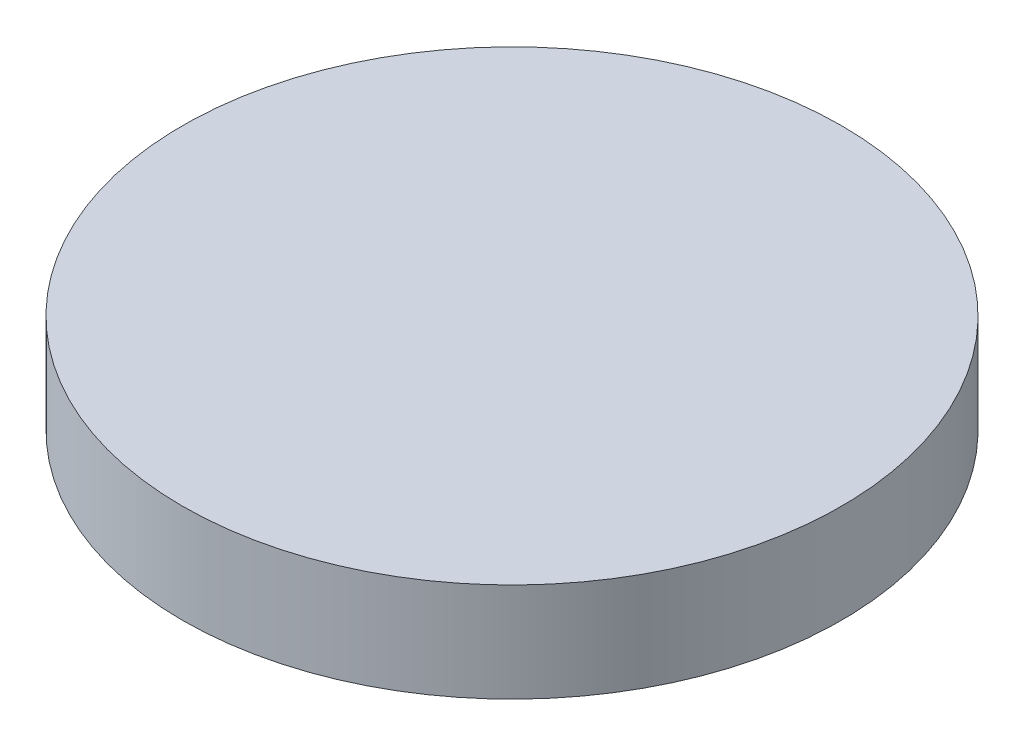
SolidWorks part; units mm, degrees
ref_plane "Front Plane" through (0, 0, 0) normal (0, 0, 1) x (1, 0, 0)
ref_plane "Top Plane" through (0, 0, 0) normal (0, 1, 0) x (1, 0, 0)
ref_plane "Right Plane" through (0, 0, 0) normal (1, 0, 0) x (0, 0, -1)
sketch "Sketch1" plane through (0, 0, 0) normal (0, 1, 0) x (1, 0, 0)
  circle A0 centre (0, 0) radius 12.7
extrude "Boss-Extrude1" add sketch "Sketch1" along normal blind 3.81
